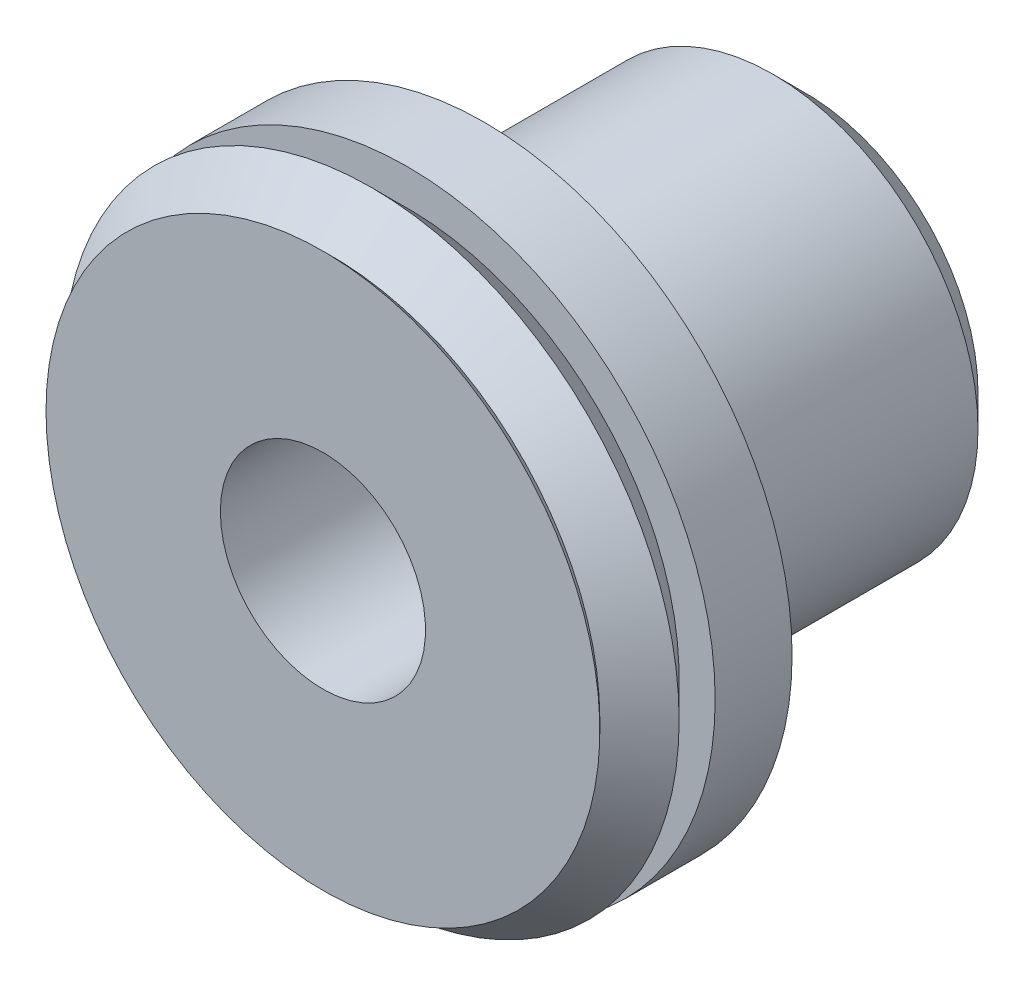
SolidWorks part; units mm, degrees
ref_plane "Front" through (0, 0, 0) normal (0, 0, 1) x (1, 0, 0)
ref_plane "Top" through (0, 0, 0) normal (0, 1, 0) x (1, 0, 0)
ref_plane "Right" through (0, 0, 0) normal (1, 0, 0) x (0, 0, -1)
ref_plane "Body Plane" through (0, 0, -3.9982) normal (0, 0, 1) x (1, 0, 0)
sketch "Sketch1" plane through (0, 0, 0) normal (1, 0, 0) x (0, 0, -1)
  line L0 (71.2941, 0) -> (-67.6458, 0) construction
  line L1 (0, 0) -> (0, 6.858)
  line L2 (0, 6.858) -> (0.2197, 6.6383)
  line L3 (0.2197, 6.6383) -> (1.2014, 7.62)
  line L4 (1.2014, 7.62) -> (2.0932, 6.7282)
  line L5 (2.0932, 6.7282) -> (2.0932, 7.62)
  line L6 (2.0932, 7.62) -> (3.9982, 7.62)
  line L7 (3.9982, 7.62) -> (3.9982, 0)
  line L8 (3.9982, 0) -> (0, 0)
  dimension "D1" = 45
  dimension "D2" = 7.62
  dimension "D3" = 7.62
  dimension "D4" = 0.8918
  dimension "D5" = 1.2014
  dimension "D6" = 6.858
  dimension "Front Length" = 1.905
revolve "Base" add sketch "Sketch1" angle 360 about L0
sketch "Sketch15" plane through (0, 0, -3.9982) normal (0, 0, 1) x (1, 0, 0)
  circle A0 centre (0, 0) radius 5.08
  dimension "D1" = 10.16
extrude "Single Acting Stud" add sketch "Sketch15" against normal blind 7.9375
chamfer "Single Acting Stud Chamfer" distance 0.7937 angle 45 1 edges at (5.08, 0, -11.9357)
sketch "Sketch3" plane through (0, 0, 0) normal (0, 0, -1) x (-1, 0, 0)
  circle A0 centre (0, 0) radius 2.54
  dimension "D1" = 5.08
extrude "Hole Cut" cut sketch "Sketch3" along normal through all
